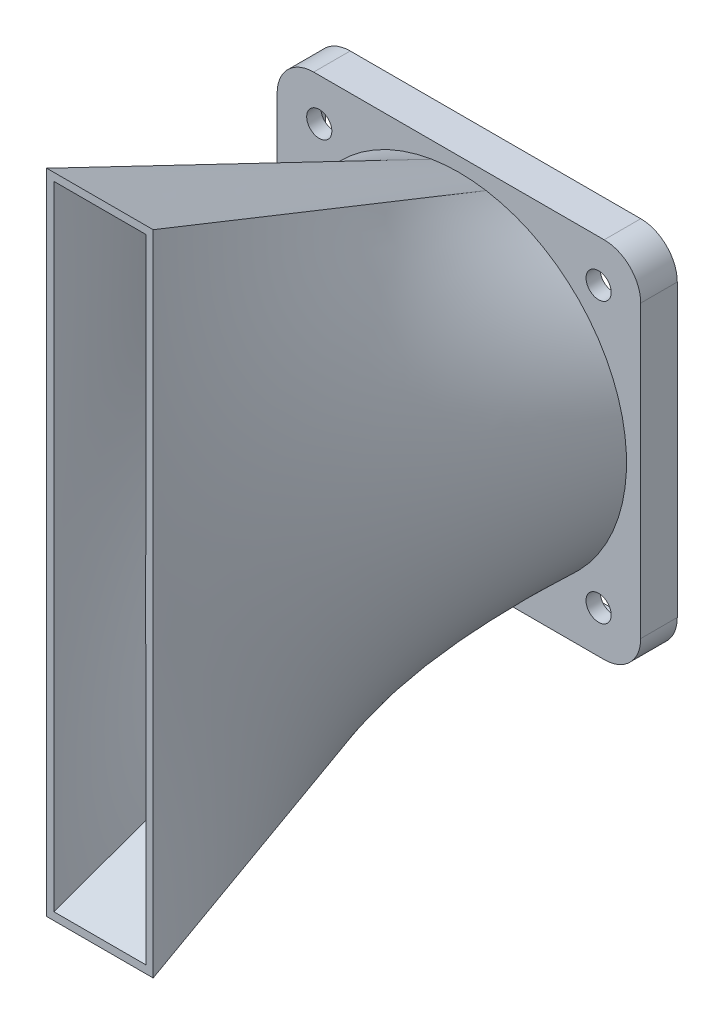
SolidWorks part; units mm, degrees
ref_plane "Front Plane" through (0, 0, 0) normal (0, 0, 1) x (1, 0, 0)
ref_plane "Top Plane" through (0, 0, 0) normal (0, 1, 0) x (1, 0, 0)
ref_plane "Right Plane" through (0, 0, 0) normal (1, 0, 0) x (0, 0, -1)
sketch "Sketch1" plane through (0, 0, 0) normal (0, 0, 1) x (1, 0, 0)
  line L8 (-1242.2558, 656.3739) -> (-1242.2558, 659.0739) construction
  line L9 (-1239.7158, 656.3739) -> (-1239.7158, 659.0739)
  line L10 (-1239.7158, 659.0739) -> (-1239.7158, 671.0739)
  line L11 (-1246.2558, 677.6139) -> (-1298.2558, 677.6139)
  line L12 (-1304.7958, 671.0739) -> (-1304.7958, 619.0739)
  line L13 (-1298.2558, 612.5339) -> (-1246.2558, 612.5339)
  line L14 (-1239.7158, 619.0739) -> (-1239.7158, 656.3739)
  line L18 (-1242.2558, 659.0739) -> (-1242.2558, 671.0739) construction
  line L19 (-1246.2558, 675.0739) -> (-1298.2558, 675.0739) construction
  line L20 (-1302.2558, 671.0739) -> (-1302.2558, 619.0739) construction
  line L21 (-1298.2558, 615.0739) -> (-1246.2558, 615.0739) construction
  line L22 (-1242.2558, 619.0739) -> (-1242.2558, 656.3739) construction
  arc A9 (-1239.7158, 671.0739) -> (-1246.2558, 677.6139) centre (-1246.2558, 671.0739) ccw
  arc A10 (-1298.2558, 677.6139) -> (-1304.7958, 671.0739) centre (-1298.2558, 671.0739) ccw
  arc A11 (-1304.7958, 619.0739) -> (-1298.2558, 612.5339) centre (-1298.2558, 619.0739) ccw
  arc A12 (-1246.2558, 612.5339) -> (-1239.7158, 619.0739) centre (-1246.2558, 619.0739) ccw
  arc A23 (-1242.2558, 671.0739) -> (-1246.2558, 675.0739) centre (-1246.2558, 671.0739) ccw construction
  arc A24 (-1298.2558, 675.0739) -> (-1302.2558, 671.0739) centre (-1298.2558, 671.0739) ccw construction
  arc A25 (-1302.2558, 619.0739) -> (-1298.2558, 615.0739) centre (-1298.2558, 619.0739) ccw construction
  arc A26 (-1246.2558, 615.0739) -> (-1242.2558, 619.0739) centre (-1246.2558, 619.0739) ccw construction
  arc A30 (-1249.5058, 620.0739) -> (-1245.0058, 620.0739) centre (-1247.2558, 620.0739) ccw
  arc A31 (-1245.0058, 620.0739) -> (-1249.5058, 620.0739) centre (-1247.2558, 620.0739) ccw
  arc A32 (-1249.5058, 670.0739) -> (-1245.0058, 670.0739) centre (-1247.2558, 670.0739) ccw
  arc A33 (-1245.0058, 670.0739) -> (-1249.5058, 670.0739) centre (-1247.2558, 670.0739) ccw
  arc A34 (-1295.0058, 670.0739) -> (-1299.5058, 670.0739) centre (-1297.2558, 670.0739) ccw
  arc A35 (-1299.5058, 670.0739) -> (-1295.0058, 670.0739) centre (-1297.2558, 670.0739) ccw
  arc A36 (-1295.0058, 620.0739) -> (-1299.5058, 620.0739) centre (-1297.2558, 620.0739) ccw
  arc A37 (-1299.5058, 620.0739) -> (-1295.0058, 620.0739) centre (-1297.2558, 620.0739) ccw
  circle A40 centre (-1272.2558, 645.0739) radius 30
  dimension "D1" = 2.54
extrude "Boss-Extrude2" add sketch "Sketch1" along normal blind 2.54
sketch "Sketch2" plane through (0, 0, 0) normal (0, 0, -1) x (-1, 0, 0)
  line L8 (1242.2558, 659.0739) -> (1242.2558, 656.3739) construction
  line L9 (1241.8558, 659.0739) -> (1241.8558, 656.3739)
  line L10 (1241.8558, 656.3739) -> (1241.8558, 619.0739)
  line L11 (1246.2558, 614.6739) -> (1298.2558, 614.6739)
  line L12 (1302.6558, 619.0739) -> (1302.6558, 671.0739)
  line L13 (1298.2558, 675.4739) -> (1246.2558, 675.4739)
  line L14 (1241.8558, 671.0739) -> (1241.8558, 659.0739)
  line L18 (1242.2558, 671.0739) -> (1242.2558, 659.0739) construction
  line L19 (1298.2558, 675.0739) -> (1246.2558, 675.0739) construction
  line L20 (1302.2558, 619.0739) -> (1302.2558, 671.0739) construction
  line L21 (1246.2558, 615.0739) -> (1298.2558, 615.0739) construction
  line L22 (1242.2558, 656.3739) -> (1242.2558, 619.0739) construction
  line L27 (1239.7158, 671.0739) -> (1239.7158, 619.0739)
  line L28 (1246.2558, 612.5339) -> (1298.2558, 612.5339)
  line L29 (1304.7958, 619.0739) -> (1304.7958, 671.0739)
  line L30 (1298.2558, 677.6139) -> (1246.2558, 677.6139)
  line L31 (1239.7158, 671.0739) -> (1239.7158, 619.0739)
  line L32 (1246.2558, 612.5339) -> (1298.2558, 612.5339)
  line L33 (1304.7958, 619.0739) -> (1304.7958, 671.0739)
  line L34 (1298.2558, 677.6139) -> (1246.2558, 677.6139)
  arc A9 (1241.8558, 619.0739) -> (1246.2558, 614.6739) centre (1246.2558, 619.0739) ccw
  arc A10 (1298.2558, 614.6739) -> (1302.6558, 619.0739) centre (1298.2558, 619.0739) ccw
  arc A11 (1302.6558, 671.0739) -> (1298.2558, 675.4739) centre (1298.2558, 671.0739) ccw
  arc A12 (1246.2558, 675.4739) -> (1241.8558, 671.0739) centre (1246.2558, 671.0739) ccw
  arc A17 (1239.7158, 619.0739) -> (1246.2558, 612.5339) centre (1246.2558, 619.0739) ccw
  arc A23 (1246.2558, 675.0739) -> (1242.2558, 671.0739) centre (1246.2558, 671.0739) ccw construction
  arc A24 (1302.2558, 671.0739) -> (1298.2558, 675.0739) centre (1298.2558, 671.0739) ccw construction
  arc A25 (1298.2558, 615.0739) -> (1302.2558, 619.0739) centre (1298.2558, 619.0739) ccw construction
  arc A26 (1242.2558, 619.0739) -> (1246.2558, 615.0739) centre (1246.2558, 619.0739) ccw construction
  arc A27 (1298.2558, 612.5339) -> (1304.7958, 619.0739) centre (1298.2558, 619.0739) ccw
  arc A28 (1304.7958, 671.0739) -> (1298.2558, 677.6139) centre (1298.2558, 671.0739) ccw
  arc A29 (1246.2558, 677.6139) -> (1239.7158, 671.0739) centre (1246.2558, 671.0739) ccw
  arc A30 (1239.7158, 619.0739) -> (1246.2558, 612.5339) centre (1246.2558, 619.0739) ccw
  arc A31 (1298.2558, 612.5339) -> (1304.7958, 619.0739) centre (1298.2558, 619.0739) ccw
  arc A32 (1304.7958, 671.0739) -> (1298.2558, 677.6139) centre (1298.2558, 671.0739) ccw
  arc A33 (1246.2558, 677.6139) -> (1239.7158, 671.0739) centre (1246.2558, 671.0739) ccw
  dimension "D1" = 0.4
  dimension "D2" = 0
extrude "Boss-Extrude3" add sketch "Sketch2" along normal up to surface (4 mm away) contours A12 L13 A11 L12 A10 L11 A9 L10 L9 L14 M45 M38 M39 M40 M41 M42 M43 M44
sketch "Sketch3" plane through (0, 0, 2.54) normal (0, 0, 1) x (1, 0, 0)
  circle A9 centre (-1272.2558, 645.0739) radius 30
  circle A10 centre (-1272.2558, 645.0739) radius 30
  dimension "D5" = 0
sketch "Sketch4" plane through (0, 0, 66.7948) normal (0, 0, 1) x (1, 0, 0)
  line L20 (-1281.7808, 587.0772) -> (-1262.7308, 587.0772)
  line L21 (-1281.7808, 587.0772) -> (-1281.7808, 703.0706)
  line L22 (-1281.7808, 703.0706) -> (-1262.7308, 703.0706)
  line L23 (-1262.7308, 587.0772) -> (-1262.7308, 703.0706)
  point P15 (-1281.7808, 587.0772)
  point P16 (-1262.7308, 703.0706)
loft "Loft-Thin2" add profiles "Sketch3", "Sketch4" parameters "D1"=1.27
sketch "Sketch6" plane through (0, 0, 2.54) normal (0, 0, -1) x (-1, 0, 0)
  arc A4 (1267.394, 674.6773) -> (1267.394, 615.4705) centre (1272.2558, 645.0739) ccw
  arc A5 (1267.394, 615.4705) -> (1277.1177, 615.4705) centre (1272.2558, 645.0739) ccw
  arc A6 (1277.1177, 615.4705) -> (1277.1177, 674.6773) centre (1272.2558, 645.0739) ccw
  arc A7 (1277.1177, 674.6773) -> (1267.394, 674.6773) centre (1272.2558, 645.0739) ccw
  arc A8 (1267.394, 674.6773) -> (1267.394, 615.4705) centre (1272.2558, 645.0739) ccw
  arc A9 (1267.394, 615.4705) -> (1277.1177, 615.4705) centre (1272.2558, 645.0739) ccw
  arc A10 (1277.1177, 615.4705) -> (1277.1177, 674.6773) centre (1272.2558, 645.0739) ccw
  arc A11 (1277.1177, 674.6773) -> (1267.394, 674.6773) centre (1272.2558, 645.0739) ccw
  spline S4 degree 3 poles (390.0549, 2765.6708) (1108.196, 7227.6729) (919.5207, 616.4648) (1456.7997, 616.4563) (1505.5109, 2427.4376) (-1293.8324, 3274.9396) knots -112.679481 -112.679481 -112.679481 -112.679481 0.5 0.5 59.713405 59.713405 59.713405 59.713405 only from (1267.6121, 616.8448) to (1276.8996, 616.8448)
  spline S5 degree 3 poles (962.3303, 4603.3749) (2049.3044, -1111.9773) (1447.5346, 717.1479) (1264.2931, 672.6162) (1263.4753, 672.3772) (1261.0777, 671.5563) (1259.5486, 670.8709) (1257.3558, 669.6418) (1256.6419, 669.1983) (1255.2485, 668.2425) (1254.5684, 667.7289) (1252.6218, 666.1164) (1251.4337, 664.9367) (1249.8116, 663.0143) (1249.2977, 662.348) (1248.5683, 661.3089) (1248.3317, 660.9553) (1247.877, 660.2417) (1247.6583, 659.8811) (1246.607, 658.0589) (1245.9007, 656.541) (1245.0415, 654.1745) (1244.7883, 653.3708) (1244.3506, 651.7327) (1244.1684, 650.9054) (1243.734, 648.4214) (1243.5887, 646.7534) (1243.5888, 644.2333) (1243.6256, 643.3898) (1243.7738, 641.6985) (1243.8841, 640.8622) (1244.3213, 638.3805) (1244.7547, 636.7626) (1245.4728, 634.7856) (1245.6253, 634.3925) (1245.9486, 633.6109) (1246.1199, 633.2216) (1246.6572, 632.0706) (1247.0469, 631.3242) (1248.3079, 629.1453) (1249.2708, 627.7735) (1250.9034, 625.8401) (1251.4818, 625.2139) (1252.6822, 624.0266) (1253.3057, 623.4633) (1255.2442, 621.8624) (1256.627, 620.9132) (1258.473, 619.8801) (1258.849, 619.6808) (1259.6059, 619.3015) (1260.7503, 618.7604) (1261.9216, 618.3013) (1376.2996, 579.3232) (1730.7141, 1276.5674) (2841.6144, 4285.564) knots -6.891993 -6.891993 -6.891993 -6.891993 0.03125 0.03125 0.0625 0.0625 0.125 0.125 0.15625 0.15625 0.1875 0.1875 0.25 0.25 0.28125 0.28125 0.296875 0.296875 0.3125 0.3125 0.375 0.375 0.40625 0.40625 0.4375 0.4375 0.5 0.5 0.53125 0.53125 0.5625 0.5625 0.625 0.625 0.640625 0.640625 0.65625 0.65625 0.6875 0.6875 0.75 0.75 0.78125 0.78125 0.8125 0.8125 0.875 0.875 0.890625 0.890625 0.90625 0.9375 0.9375 5.41573 5.41573 5.41573 5.41573 only from (1267.6121, 673.3029) to (1267.6121, 616.8448)
  spline S6 degree 3 poles (2154.4568, -1475.523) (1436.3157, -5937.5251) (1624.991, 673.683) (1087.712, 673.6915) (1039.0008, -1137.2899) (3838.3441, -1984.7918) knots -112.679481 -112.679481 -112.679481 -112.679481 0.5 0.5 59.713405 59.713405 59.713405 59.713405 only from (1276.8996, 673.3029) to (1267.6121, 673.3029)
  spline S7 degree 3 poles (1582.1821, -3313.2298) (495.199, 2402.1451) (1096.9761, 572.9996) (1280.2186, 617.5316) (1281.0364, 617.7706) (1283.434, 618.5915) (1284.9631, 619.2769) (1287.1559, 620.506) (1287.8698, 620.9494) (1289.2632, 621.9053) (1289.9433, 622.4189) (1291.8899, 624.0314) (1293.078, 625.2111) (1294.7001, 627.1335) (1295.214, 627.7998) (1295.9434, 628.8389) (1296.18, 629.1925) (1296.6347, 629.9061) (1296.8534, 630.2667) (1297.9047, 632.0888) (1298.611, 633.6068) (1299.4702, 635.9733) (1299.7234, 636.777) (1300.1611, 638.4151) (1300.3433, 639.2424) (1300.7777, 641.7264) (1300.923, 643.3944) (1300.9229, 645.9144) (1300.8861, 646.758) (1300.7379, 648.4493) (1300.6276, 649.2856) (1300.1904, 651.7672) (1299.757, 653.3852) (1299.0389, 655.3622) (1298.8864, 655.7553) (1298.5631, 656.5369) (1298.3918, 656.9262) (1297.8545, 658.0772) (1297.4648, 658.8236) (1296.2038, 661.0025) (1295.2409, 662.3743) (1293.6083, 664.3077) (1293.0299, 664.9339) (1291.8295, 666.1211) (1291.206, 666.6845) (1289.2675, 668.2854) (1287.8847, 669.2346) (1286.0387, 670.2677) (1285.6627, 670.467) (1284.9058, 670.8463) (1283.7614, 671.3874) (1282.5901, 671.8465) (1168.2115, 710.8248) (813.7944, 13.5733) (-297.1136, -2995.449) knots -6.892033 -6.892033 -6.892033 -6.892033 0.03125 0.03125 0.0625 0.0625 0.125 0.125 0.15625 0.15625 0.1875 0.1875 0.25 0.25 0.28125 0.28125 0.296875 0.296875 0.3125 0.3125 0.375 0.375 0.40625 0.40625 0.4375 0.4375 0.5 0.5 0.53125 0.53125 0.5625 0.5625 0.625 0.625 0.640625 0.640625 0.65625 0.65625 0.6875 0.6875 0.75 0.75 0.78125 0.78125 0.8125 0.8125 0.875 0.875 0.890625 0.890625 0.90625 0.9375 0.9375 5.415752 5.415752 5.415752 5.415752 only from (1276.8996, 616.8448) to (1276.8996, 673.3029)
  spline S8 degree 3 poles (1267.6121, 616.8448) (1269.1494, 616.5883) (1270.6971, 616.4592) (1273.8137, 616.4592) (1275.3623, 616.5883) (1276.8996, 616.8448) knots 0 0 0 0 0.5 0.5 1 1 1 1
  spline S9 degree 3 poles (1267.6121, 673.3029) (1266.7718, 673.1783) (1265.9399, 673.0164) (1264.2931, 672.6162) (1263.4753, 672.3772) (1261.0777, 671.5563) (1259.5486, 670.8709) (1257.3558, 669.6418) (1256.6419, 669.1983) (1255.2485, 668.2425) (1254.5684, 667.7289) (1252.6218, 666.1164) (1251.4337, 664.9367) (1249.8116, 663.0143) (1249.2977, 662.348) (1248.5683, 661.3089) (1248.3317, 660.9553) (1247.877, 660.2417) (1247.6583, 659.8811) (1246.607, 658.0589) (1245.9007, 656.541) (1245.0415, 654.1745) (1244.7883, 653.3708) (1244.3506, 651.7327) (1244.1684, 650.9054) (1243.734, 648.4214) (1243.5887, 646.7534) (1243.5888, 644.2333) (1243.6256, 643.3898) (1243.7738, 641.6985) (1243.8841, 640.8622) (1244.3213, 638.3805) (1244.7547, 636.7626) (1245.4728, 634.7856) (1245.6253, 634.3925) (1245.9486, 633.6109) (1246.1199, 633.2216) (1246.6572, 632.0706) (1247.0469, 631.3242) (1248.3079, 629.1453) (1249.2708, 627.7735) (1250.9034, 625.8401) (1251.4818, 625.2139) (1252.6822, 624.0266) (1253.3057, 623.4633) (1255.2442, 621.8624) (1256.627, 620.9132) (1258.473, 619.8801) (1258.849, 619.6808) (1259.6059, 619.3015) (1260.7503, 618.7604) (1261.9216, 618.3013) (1264.2995, 617.491) (1265.9316, 617.0941) (1267.6121, 616.8448) knots 0 0 0 0 0.03125 0.03125 0.0625 0.0625 0.125 0.125 0.15625 0.15625 0.1875 0.1875 0.25 0.25 0.28125 0.28125 0.296875 0.296875 0.3125 0.3125 0.375 0.375 0.40625 0.40625 0.4375 0.4375 0.5 0.5 0.53125 0.53125 0.5625 0.5625 0.625 0.625 0.640625 0.640625 0.65625 0.65625 0.6875 0.6875 0.75 0.75 0.78125 0.78125 0.8125 0.8125 0.875 0.875 0.890625 0.890625 0.90625 0.9375 0.9375 1 1 1 1
  spline S10 degree 3 poles (1276.8996, 673.3029) (1275.3623, 673.5595) (1273.8146, 673.6886) (1270.698, 673.6886) (1269.1494, 673.5595) (1267.6121, 673.3029) knots 0 0 0 0 0.5 0.5 1 1 1 1
  spline S11 degree 3 poles (1276.8996, 616.8448) (1277.7399, 616.9695) (1278.5718, 617.1314) (1280.2186, 617.5316) (1281.0364, 617.7706) (1283.434, 618.5915) (1284.9631, 619.2769) (1287.1559, 620.506) (1287.8698, 620.9494) (1289.2632, 621.9053) (1289.9433, 622.4189) (1291.8899, 624.0314) (1293.078, 625.2111) (1294.7001, 627.1335) (1295.214, 627.7998) (1295.9434, 628.8389) (1296.18, 629.1925) (1296.6347, 629.9061) (1296.8534, 630.2667) (1297.9047, 632.0888) (1298.611, 633.6068) (1299.4702, 635.9733) (1299.7234, 636.777) (1300.1611, 638.4151) (1300.3433, 639.2424) (1300.7777, 641.7264) (1300.923, 643.3944) (1300.9229, 645.9144) (1300.8861, 646.758) (1300.7379, 648.4493) (1300.6276, 649.2856) (1300.1904, 651.7672) (1299.757, 653.3852) (1299.0389, 655.3622) (1298.8864, 655.7553) (1298.5631, 656.5369) (1298.3918, 656.9262) (1297.8545, 658.0772) (1297.4648, 658.8236) (1296.2038, 661.0025) (1295.2409, 662.3743) (1293.6083, 664.3077) (1293.0299, 664.9339) (1291.8295, 666.1211) (1291.206, 666.6845) (1289.2675, 668.2854) (1287.8847, 669.2346) (1286.0387, 670.2677) (1285.6627, 670.467) (1284.9058, 670.8463) (1283.7614, 671.3874) (1282.5901, 671.8465) (1280.2122, 672.6568) (1278.5801, 673.0537) (1276.8996, 673.3029) knots 0 0 0 0 0.03125 0.03125 0.0625 0.0625 0.125 0.125 0.15625 0.15625 0.1875 0.1875 0.25 0.25 0.28125 0.28125 0.296875 0.296875 0.3125 0.3125 0.375 0.375 0.40625 0.40625 0.4375 0.4375 0.5 0.5 0.53125 0.53125 0.5625 0.5625 0.625 0.625 0.640625 0.640625 0.65625 0.65625 0.6875 0.6875 0.75 0.75 0.78125 0.78125 0.8125 0.8125 0.875 0.875 0.890625 0.890625 0.90625 0.9375 0.9375 1 1 1 1
  dimension "D1" = 0
  dimension "D2" = 0
extrude "Boss-Extrude5" add sketch "Sketch6" along normal up to surface (2.54 mm away)
